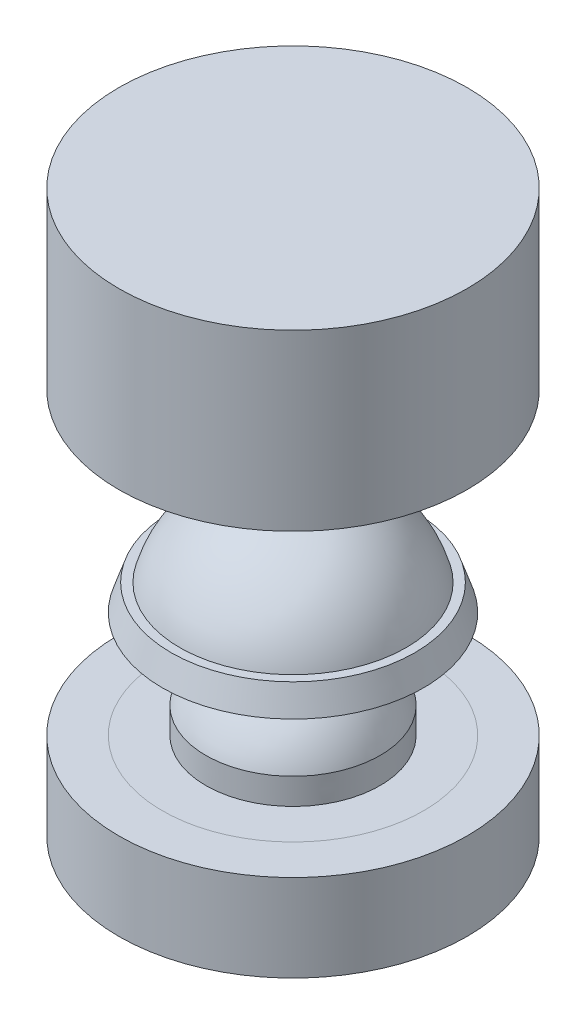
SolidWorks part; units mm, degrees
ref_plane "Front Plane" through (0, 0, 0) normal (0, 0, 1) x (1, 0, 0)
ref_plane "Top Plane" through (0, 0, 0) normal (0, 1, 0) x (1, 0, 0)
ref_plane "Right Plane" through (0, 0, 0) normal (1, 0, 0) x (0, 0, -1)
sketch "Sketch1" plane through (0, 0, 0) normal (0, 0, 1) x (1, 0, 0)
  line L0 (14.8295, 3) -> (14.8278, 0)
  line L1 (14.8278, 0) -> (19.8278, 0)
  line L2 (4.8278, 0) -> (4.8278, 13) construction
  line L4 (18.8278, 3) -> (17.8278, 3)
  line L6 (4.8278, 10.13) -> (4.8278, 13)
  line L8 (18.8278, 3) -> (19.8278, 0)
  line L12 (7.6978, 2.87) -> (14.8278, 2.87) construction
  line L13 (14.8278, 2.87) -> (14.8734, 2.87) construction
  line L14 (14.8734, 2.87) -> (14.8734, 2.87) construction
  line L15 (14.8734, 2.87) -> (14.8734, 2.87) construction
  line L16 (7.6978, 2.87) -> (7.6978, 9.7333) construction
  line L17 (4.8278, 0) -> (14.8278, 0) construction
  arc A0 (4.8278, 13) -> (17.8278, 3) centre (4.8278, -0.45) cw
  arc A1 (4.8278, 10.13) -> (14.8295, 3) centre (4.8278, -0.45) cw
  arc A2 (7.6978, 9.7333) -> (14.8734, 2.87) centre (4.8278, -0.45) cw construction
revolve "Revolve1" add sketch "Sketch1" angle 360 about L6
scale "Scale1" scale about centroid uniform scaling yes scale factor 1
other "Parting Line1"
other "Parting Surface1" parameters "D1"=11.1
sketch "Sketch2" plane through (0, 0, 0) normal (0, 1, 0) x (1, 0, 0)
  line L0 (4.8278, 0) -> (14.8295, 0) construction
  line L1 (4.8278, 0) -> (17.8278, 0) construction
  circle A0 centre (4.8278, 0) radius 20
  dimension "D1" = 40
other "Tooling Split1" parameters "D1"=10, "D2"=20, "D3"=3
move or copy body "Body-Move/Copy5" bodies to move or copy 108 copy no translate (0, -34.4321, 0)
move or copy body "Body-Move/Copy6" bodies to move or copy 103 copy no translate (0, -22.2088, 0)
